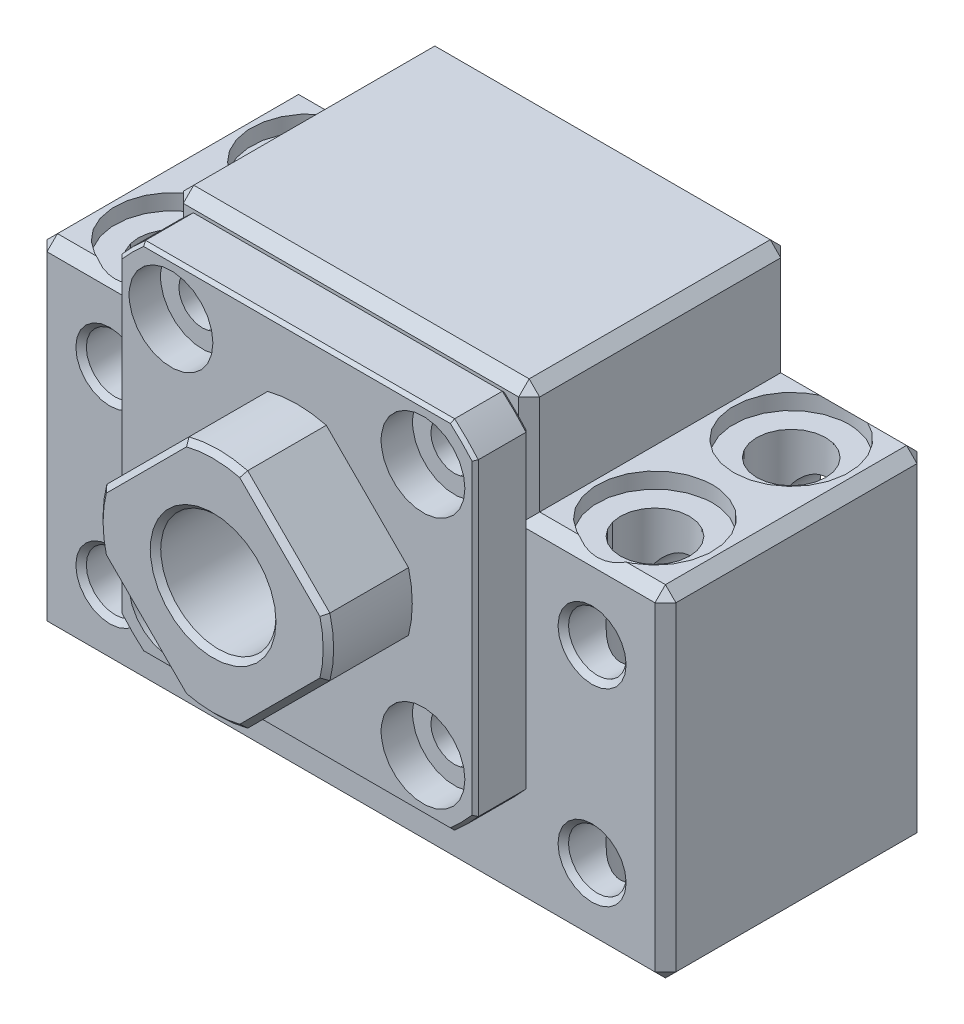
SolidWorks part; units mm, degrees
other "Solid1"
other "Solid2"
other "Solid3"
other "Solid4"
other "Solid5"
other "Solid6"
other "Solid7"
other "Solid8"
other "Solid9"
other "Solid10"
other "Solid11"
other "Solid12"
other "Solid13"
other "Solid14"
other "Solid15"
other "Solid16"
other "Solid17"
other "Solid18"
other "Solid19"
other "Solid20"
other "Solid21"
other "Solid22"
other "Solid23"
other "Solid24"
other "Solid25"
other "Solid26"
other "Solid27"
other "Solid28"
other "Solid29"
other "Solid30"
other "Solid31"
other "Solid32"
other "Solid33"
other "Solid34"
other "Solid35"
ref_plane "Front Plane" through (0, 0, 0) normal (0, 0, 1) x (1, 0, 0)
ref_plane "Top Plane" through (0, 0, 0) normal (0, 1, 0) x (1, 0, 0)
ref_plane "Right Plane" through (0, 0, 0) normal (1, 0, 0) x (0, 0, -1)
imported_body "2.4006 BK12.stp<1>"
sketch "Sketch2" plane through (0, 0, 14) normal (0, 0, -1) x (-1, 0, 0)
  line L0 (2.7964, 35.6386) -> (10.6386, 27.7964) construction
  line L1 (10.6386, 22.2036) -> (2.7964, 14.3614) construction
  line L2 (-2.7964, 14.3614) -> (-10.6386, 22.2036) construction
  line L3 (-10.6386, 27.7964) -> (-2.7964, 35.6386) construction
  line L4 (2.7964, 35.6386) -> (10.6386, 27.7964)
  line L5 (10.6386, 22.2036) -> (2.7964, 14.3614)
  line L6 (-2.7964, 14.3614) -> (-10.6386, 22.2036)
  line L7 (-10.6386, 27.7964) -> (-2.7964, 35.6386)
  arc A0 (-5.3499, 23.7237) -> (0, 19.5) centre (0, 25) ccw construction
  arc A1 (0, 19.5) -> (-5.3499, 23.7237) centre (0, 25) ccw construction
  arc A2 (2.7964, 35.6386) -> (-2.7964, 35.6386) centre (0, 25) ccw construction
  arc A3 (10.6386, 22.2036) -> (10.6386, 27.7964) centre (0, 25) ccw construction
  arc A4 (-2.7964, 14.3614) -> (2.7964, 14.3614) centre (0, 25) ccw construction
  arc A5 (-10.6386, 27.7964) -> (-10.6386, 22.2036) centre (0, 25) ccw construction
  arc A6 (-5.3499, 23.7237) -> (0, 19.5) centre (0, 25) ccw
  arc A7 (0, 19.5) -> (-5.3499, 23.7237) centre (0, 25) ccw
  arc A8 (2.7964, 35.6386) -> (-2.7964, 35.6386) centre (0, 25) ccw
  arc A9 (10.6386, 22.2036) -> (10.6386, 27.7964) centre (0, 25) ccw
  arc A10 (-2.7964, 14.3614) -> (2.7964, 14.3614) centre (0, 25) ccw
  arc A11 (-10.6386, 27.7964) -> (-10.6386, 22.2036) centre (0, 25) ccw
extrude "Boss-Extrude2" add sketch "Sketch2" against normal blind 11.65
chamfer "Chamfer1" distance 0.5 angle 45 9 edges at (6.7175, 31.7175, 25.65) (11, 25, 25.65) (6.7175, 18.2825, 25.65) (0, 14, 25.65) (-6.7175, 18.2825, 25.65) (-11, 25, 25.65) (-6.7175, 31.7175, 25.65) (0, 36, 25.65) (-5.5, 25, 25.65)
sketch "Sketch3" plane through (0, 0, 17.65) normal (0, 0, 1) x (1, 0, 0)
  circle A0 centre (0, 25) radius 12.5
  circle A1 centre (0, 25) radius 7.7675
extrude "Boss-Extrude3" add sketch "Sketch3" against normal blind 5
